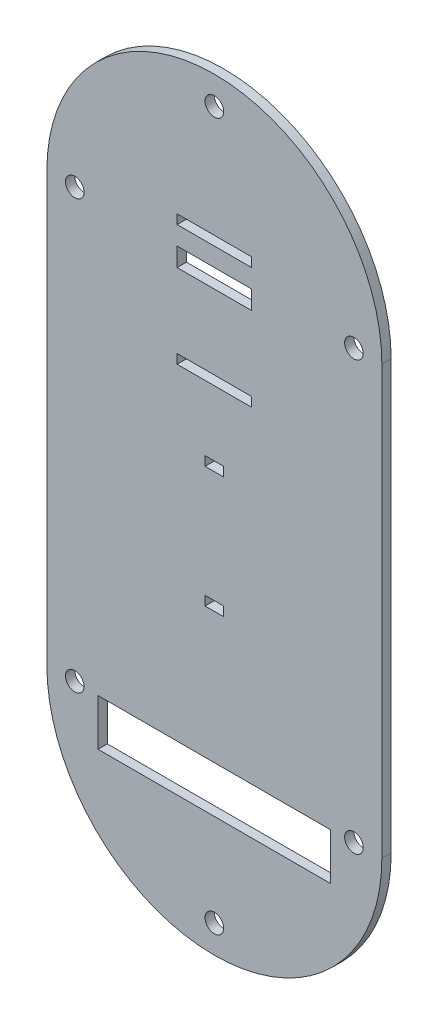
SolidWorks part; units mm, degrees
ref_plane "Front Plane" through (0, 0, 0) normal (0, 0, 1) x (1, 0, 0)
ref_plane "Top Plane" through (0, 0, 0) normal (0, 1, 0) x (1, 0, 0)
ref_plane "Right Plane" through (0, 0, 0) normal (1, 0, 0) x (0, 0, -1)
sketch "Sketch1" plane through (0, 0, 0) normal (0, 0, 1) x (1, 0, 0)
  line L1 (49.3498, 34.5117) -> (23.9498, 34.5117)
  line L2 (-20.5002, 34.5117) -> (-20.5002, -111.5383)
  line L3 (49.3498, 34.5117) -> (49.3498, 28.1617)
  line L4 (93.7998, 34.5117) -> (93.7998, -111.5383)
  line L5 (49.3498, 28.1617) -> (23.9498, 28.1617)
  line L6 (23.9498, 34.5117) -> (23.9498, 28.1617)
  line L7 (39.8248, -22.6383) -> (33.4748, -22.6383)
  line L8 (39.8248, -22.6383) -> (39.8248, -25.8133)
  line L9 (39.8248, -25.8133) -> (33.4748, -25.8133)
  line L10 (33.4748, -22.6383) -> (33.4748, -25.8133)
  line L11 (39.8248, -63.9133) -> (33.4748, -63.9133)
  line L12 (39.8248, -63.9133) -> (39.8248, -67.0883)
  line L13 (39.8248, -67.0883) -> (33.4748, -67.0883)
  line L14 (33.4748, -63.9133) -> (33.4748, -67.0883)
  line L15 (49.3498, 44.0367) -> (23.9498, 44.0367)
  line L16 (49.3498, 44.0367) -> (49.3498, 40.8617)
  line L17 (49.3498, 40.8617) -> (23.9498, 40.8617)
  line L18 (23.9498, 44.0367) -> (23.9498, 40.8617)
  line L19 (49.3498, 2.7617) -> (23.9498, 2.7617)
  line L20 (49.3498, 2.7617) -> (49.3498, -0.4133)
  line L21 (49.3498, -0.4133) -> (23.9498, -0.4133)
  line L22 (23.9498, 2.7617) -> (23.9498, -0.4133)
  line L23 (76.3373, -111.7913) -> (-3.0377, -111.7913)
  line L24 (76.3373, -111.7913) -> (76.3373, -127.6663)
  line L25 (76.3373, -127.6663) -> (-3.0377, -127.6663)
  line L26 (-3.0377, -111.7913) -> (-3.0377, -127.6663)
  arc A0 (93.7998, 34.5117) -> (-20.5002, 34.5117) centre (36.6498, 34.5117) ccw
  arc A1 (-20.5002, -111.5383) -> (93.7998, -111.5383) centre (36.6498, -111.5383) ccw
  circle A8 centre (36.6498, 82.1367) radius 3.175
  circle A9 centre (84.2748, 34.5117) radius 3.175
  circle A10 centre (-10.9752, 34.5117) radius 3.175
  circle A11 centre (-10.9752, -111.5383) radius 3.175
  circle A12 centre (84.2748, -111.5383) radius 3.175
  circle A13 centre (36.6498, -159.1633) radius 3.175
  dimension "D3" = 114.3
  dimension "D5" = 114.3
  dimension "D4" = 9.525
  dimension "D6" = 3.175
  dimension "D7" = 6.35
  dimension "D8" = 25.4
  dimension "D9" = 3.175
  dimension "D10" = 25.4
  dimension "D11" = 6.35
  dimension "D12" = 6.35
  dimension "D13" = 6.35
  dimension "D14" = 6.35
  dimension "D15" = 6.35
  dimension "D16" = 6.35
  dimension "D1" = 114.3
  dimension "D2" = 146.05
  dimension "D17" = 3.175
  dimension "D18" = 3.175
  dimension "D19" = 6.35
  dimension "D20" = 6.35
  dimension "D21" = 6.35
  dimension "D22" = 53.975
  dimension "D23" = 53.975
  dimension "D24" = 25.4
  dimension "D25" = 44.45
  dimension "D26" = 0
  dimension "D27" = 50.8
  dimension "D28" = 38.1
  dimension "D29" = 15.875
  dimension "D30" = 79.375
  dimension "D31" = 17.4625
extrude "Boss-Extrude1" add sketch "Sketch1" along normal blind 3.175
